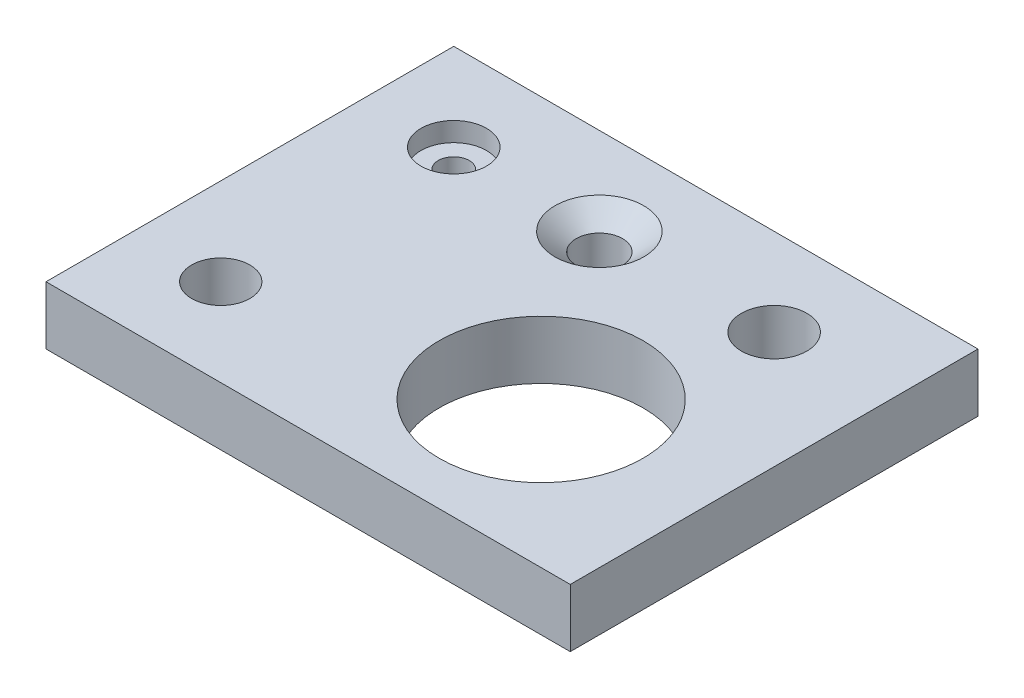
SolidWorks part; units mm, degrees
ref_plane "Front Plane" through (0, 0, 0) normal (0, 0, 1) x (1, 0, 0)
ref_plane "Top Plane" through (0, 0, 0) normal (0, 1, 0) x (1, 0, 0)
ref_plane "Right Plane" through (0, 0, 0) normal (1, 0, 0) x (0, 0, -1)
sketch "Sketch1" plane through (0, 0, 0) normal (0, 1, 0) x (1, 0, 0)
  line L0 (-57.15, -44.45) -> (57.15, 44.45) construction
  line L1 (-57.15, 44.45) -> (57.15, 44.45)
  line L2 (-57.15, 44.45) -> (-57.15, -44.45)
  line L3 (-57.15, -44.45) -> (57.15, -44.45)
  line L4 (57.15, 44.45) -> (57.15, -44.45)
  dimension "D1" = 114.3
  dimension "D2" = 88.9
extrude "Extrude1" add sketch "Sketch1" along normal blind 12.7
hole_wizard "CBORE for 1/4 Binding Head Machine Screw2" positions "Sketch11" profile "Sketch10" counterbore size "1/4" standard "Ansi Inch"
sketch "Sketch11" plane through (0, 12.7, 0) normal (0, 1, 0) x (-1, 0, 0)
  line L0 (57.15, -44.45) -> (57.15, 44.45) construction
  line L1 (-57.15, -44.45) -> (57.15, -44.45) construction
  point P0 (38.1, -25.4)
  dimension "D1" = 19.05
  dimension "D2" = 19.05
sketch "Sketch10" plane through (-38.1, 12.7, -25.4) normal (1, 0, 0) x (0, 0, 1)
  line L0 (0, 0) -> (0, 12.7)
  line L1 (0, 12.7) -> (3.3782, 12.7)
  line L3 (3.3782, 12.7) -> (3.3782, 4.191)
  line L4 (3.3782, 4.191) -> (7.1437, 4.191)
  line L5 (7.1437, 4.191) -> (7.1437, 0)
  line L7 (7.1437, 0) -> (0, 0)
  line L11 (0, -6.35) -> (0, 107.95) construction
  dimension "Thru Hole Dia." = 6.7564
  dimension "Thru Hole Depth" = 12.7
  dimension "C'Bore Dia." = 14.2875
  dimension "C'Bore Depth" = 4.191
hole_wizard "CSK for 3/8 Flat Head Machine Screw (100)1" positions "Sketch6" profile "Sketch5" countersink size "3/8" standard "Ansi Inch"
sketch "Sketch6" plane through (0, 12.7, 0) normal (0, 1, 0) x (-1, 0, 0)
  line L0 (57.15, -44.45) -> (57.15, 44.45) construction
  line L1 (-57.15, -44.45) -> (57.15, -44.45) construction
  point P0 (6.35, -25.4)
  dimension "D1" = 50.8
  dimension "D2" = 19.05
sketch "Sketch5" plane through (-6.35, 12.7, -25.4) normal (1, 0, 0) x (0, 0, 1)
  line L0 (0, 0) -> (0, 12.7)
  line L1 (0, 12.7) -> (5.0419, 12.7)
  line L2 (5.0419, 12.7) -> (5.0419, 3.8896)
  line L3 (5.0419, 3.8896) -> (9.6774, 0)
  line L5 (9.6774, 0) -> (0, 0)
  line L6 (-5.0419, 3.8896) -> (-9.6774, 0) construction
  line L11 (0, -6.35) -> (0, 107.95) construction
  dimension "Thru Hole Dia." = 10.0838
  dimension "Thru Hole Depth" = 12.7
  dimension "Near C'Sink Dia." = 19.3548
  dimension "Near C'Sink Angle" = 100
hole_wizard "1/2-20 Tapped Hole1" positions "Sketch15" profile "Sketch14" tap size "1/2-20" standard "Ansi Inch"
sketch "Sketch15" plane through (0, 12.7, 0) normal (0, 1, 0) x (-1, 0, 0)
  line L0 (57.15, -44.45) -> (57.15, 44.45) construction
  line L1 (57.15, 44.45) -> (-57.15, 44.45) construction
  point P0 (38.1, 25.4)
  dimension "D1" = 19.05
  dimension "D2" = 19.05
sketch "Sketch14" plane through (-38.1, 12.7, 25.4) normal (1, 0, 0) x (0, 0, 1)
  line L0 (0, 0) -> (0, 32.6676)
  line L1 (0, 32.6676) -> (5.7544, 29.21)
  line L2 (5.7544, 29.21) -> (5.7544, 25.4)
  line L3 (5.7544, 25.4) -> (6.35, 25.4)
  line L4 (6.35, 25.4) -> (6.35, 0)
  line L5 (6.35, 0) -> (0, 0)
  line L10 (0, 32.6676) -> (-5.7544, 29.21) construction
  line L11 (0, -6.35) -> (0, 107.95) construction
  dimension "Tap Drill Dia." = 11.5087
  dimension "Tap Drill Depth" = 29.21
  dimension "Thread Major Dia." = 12.7
  dimension "Thread Depth" = 25.4
  dimension "Drill Angle" = 118
hole_wizard "9/16 (0.5625) Diameter Hole1" positions "Sketch13" profile "Sketch12" hole size "9/16" standard "Ansi Inch"
sketch "Sketch13" plane through (0, 12.7, 0) normal (0, 1, 0) x (-1, 0, 0)
  line L0 (-57.15, -44.45) -> (57.15, -44.45) construction
  line L1 (57.15, -44.45) -> (57.15, 44.45) construction
  point P0 (-31.75, -25.4)
  dimension "D1" = 19.05
  dimension "D2" = 88.9
sketch "Sketch12" plane through (31.75, 12.7, -25.4) normal (1, 0, 0) x (0, 0, 1)
  line L0 (0, 0) -> (0, 29.6924)
  line L1 (0, 29.6924) -> (7.1437, 25.4)
  line L2 (7.1437, 25.4) -> (7.1437, 0)
  line L5 (7.1437, 0) -> (0, 0)
  line L10 (0, 29.6924) -> (-7.1438, 25.4) construction
  line L11 (0, -6.35) -> (0, 107.95) construction
  dimension "Hole Dia." = 14.2875
  dimension "Hole Depth" = 25.4
  dimension "Drill Angle" = 118
sketch "Sketch9" plane through (0, 12.7, 0) normal (0, 1, 0) x (-1, 0, 0)
  line L0 (57.15, -44.45) -> (57.15, 44.45) construction
  line L1 (57.15, 44.45) -> (-57.15, 44.45) construction
  circle A0 centre (-19.05, 12.7) radius 22.225
  dimension "D1" = 44.45
  dimension "D2" = 76.2
  dimension "D3" = 31.75
extrude "Large Hole Cut" cut sketch "Sketch9" against normal through all
